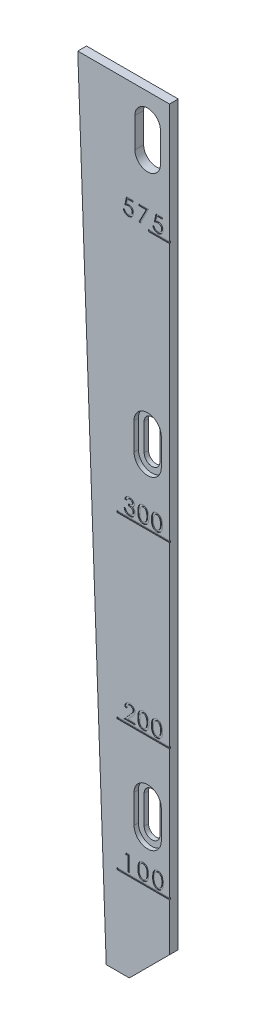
SolidWorks part; units mm, degrees
ref_plane "Front Plane" through (0, 0, 0) normal (0, 0, 1) x (1, 0, 0)
ref_plane "Top Plane" through (0, 0, 0) normal (0, 1, 0) x (1, 0, 0)
ref_plane "Right Plane" through (0, 0, 0) normal (1, 0, 0) x (0, 0, -1)
sketch "Sketch1" plane through (0, 0, 0) normal (0, 0, 1) x (1, 0, 0)
  line L0 (0, 0) -> (-29.7001, 0) construction
  line L1 (0, 0) -> (0, -107.0864) construction
  line L2 (0, 0) -> (-13.335, 0)
  line L3 (0, 0) -> (0, -107.0864)
  line L4 (-5.842, -112.9284) -> (-9.1948, -112.9284)
  line L5 (-13.335, 0) -> (-9.1948, -112.9284)
  line L6 (-3.175, 0) -> (-3.175, -112.9284) construction
  line L7 (-3.175, -3.9624) -> (-3.175, -8.2804) construction
  line L8 (-1.3208, -3.9624) -> (-1.3208, -8.2804)
  line L9 (-5.0292, -3.9624) -> (-5.0292, -8.2804)
  line L10 (-3.175, -42.4323) -> (-3.175, -46.3804) construction
  line L11 (-2.032, -42.4323) -> (-2.032, -46.3804)
  line L12 (-4.318, -42.4323) -> (-4.318, -46.3804)
  line L13 (-3.175, -93.3704) -> (-3.175, -89.2302) construction
  line L14 (-4.318, -93.3704) -> (-4.318, -89.2302)
  line L15 (-2.032, -93.3704) -> (-2.032, -89.2302)
  line L16 (-5.842, -112.9284) -> (0, -107.0864)
  line L17 (0, -112.9284) -> (0, -136.3505) construction
  arc A0 (-1.3208, -3.9624) -> (-5.0292, -3.9624) centre (-3.175, -3.9624) ccw
  arc A1 (-5.0292, -8.2804) -> (-1.3208, -8.2804) centre (-3.175, -8.2804) ccw
  arc A2 (-2.032, -42.4323) -> (-4.318, -42.4323) centre (-3.175, -42.4323) ccw
  arc A3 (-4.318, -46.3804) -> (-2.032, -46.3804) centre (-3.175, -46.3804) ccw
  arc A4 (-4.318, -93.3704) -> (-2.032, -93.3704) centre (-3.175, -93.3704) ccw
  arc A5 (-2.032, -89.2302) -> (-4.318, -89.2302) centre (-3.175, -89.2302) ccw
  point P11 (-3.175, -6.1214)
  point P16 (-3.175, -44.4064)
  point P23 (-3.175, -91.3003)
  point P30 (-7.5184, -112.9284)
  point P33 (-1.3208, -6.1214)
  dimension "D7" = 2.286
  dimension "D1" = 13.335
  dimension "D2" = 112.9284
  dimension "D3" = 9.1948
  dimension "D4" = 3.175
  dimension "D5" = 3.7084
  dimension "D6" = 4.318
  dimension "D8" = 2.286
  dimension "D9" = 19.558
  dimension "D10" = 4.1402
  dimension "D11" = 46.99
  dimension "D12" = 104.648
  dimension "D13" = 45
  dimension "D14" = 5.842
  dimension "D15" = 6.1214
extrude "Boss-Extrude1" add sketch "Sketch1" against normal blind 1.27
sketch "Sketch2" plane through (0, 0, 0) normal (0, 0, 1) x (1, 0, 0)
  line L0 (-3.175, -42.4323) -> (-3.175, -46.3804) construction
  line L1 (-1.1938, -42.4323) -> (-1.1938, -46.3804)
  line L2 (-5.1562, -42.4323) -> (-5.1562, -46.3804)
  line L3 (-3.175, -93.3704) -> (-3.175, -89.2302) construction
  line L4 (-5.1562, -93.3704) -> (-5.1562, -89.2302)
  line L5 (-1.1938, -93.3704) -> (-1.1938, -89.2302)
  arc A0 (-1.1938, -42.4323) -> (-5.1562, -42.4323) centre (-3.175, -42.4323) ccw
  arc A1 (-5.1562, -46.3804) -> (-1.1938, -46.3804) centre (-3.175, -46.3804) ccw
  arc A2 (-5.1562, -93.3704) -> (-1.1938, -93.3704) centre (-3.175, -93.3704) ccw
  arc A3 (-1.1938, -89.2302) -> (-5.1562, -89.2302) centre (-3.175, -89.2302) ccw
  point P4 (-3.175, -44.4064)
  point P13 (-3.175, -91.3003)
  dimension "D1" = 3.9624
  dimension "D2" = 3.9624
extrude "Cut-Extrude1" cut sketch "Sketch2" against normal blind 0.635
sketch "Sketch3" plane through (0, 0, 0) normal (0, 0, 1) x (1, 0, 0)
  line L0 (0, -55.0926) -> (-7.62, -55.0926) construction
  line L1 (0, -107.0864) -> (0, 0) construction
  line L2 (0, -81.0514) -> (-7.62, -81.0514) construction
  line L3 (0, -100.0506) -> (-7.62, -100.0506) construction
  line L4 (0, -54.9656) -> (-7.62, -54.9656)
  line L5 (0, -80.9244) -> (-7.62, -80.9244)
  line L6 (0, -99.9236) -> (-7.62, -99.9236)
  line L7 (0, -55.2196) -> (-7.62, -55.2196)
  line L8 (0, -81.1784) -> (-7.62, -81.1784)
  line L9 (0, -100.1776) -> (-7.62, -100.1776)
  line L10 (-7.62, -54.9656) -> (-7.62, -55.2196)
  line L11 (0, -54.9656) -> (0, -55.2196)
  line L12 (-7.62, -80.9244) -> (-7.62, -81.1784)
  line L13 (0, -80.9244) -> (0, -81.1784)
  line L14 (-7.62, -99.9236) -> (-7.62, -100.1776)
  line L15 (0, -99.9236) -> (0, -100.1776)
  line L16 (0, -17.4498) -> (-3.048, -17.4498) construction
  line L17 (0, -17.3228) -> (-3.048, -17.3228)
  line L18 (0, -17.5768) -> (-3.048, -17.5768)
  line L19 (-3.048, -17.3228) -> (-3.048, -17.5768)
  line L20 (0, -17.5768) -> (0, -17.3228)
  line L21 (0, 0) -> (-13.335, 0) construction
  dimension "D1" = 7.62
  dimension "D2" = 7.62
  dimension "D3" = 7.62
  dimension "D4" = 8.7122
  dimension "D5" = 25.9588
  dimension "D6" = 6.6802
  dimension "D9" = 3.048
  dimension "D12" = 17.4498
  dimension "D7" = 0.127
  dimension "D8" = 0.127
  dimension "D10" = 0.127
  dimension "D11" = 0.127
extrude "Cut-Extrude2" cut sketch "Sketch3" against normal blind 0.127 contours L17 L19 L18 M17 | L7 L10 L4 L11 | L8 L12 L5 L13 | L9 L14 L6 L15
sketch "Sketch4" plane through (0, 0, 0) normal (0, 0, 1) x (1, 0, 0)
  line L0 (0, -99.6696) -> (-7.6053, -99.6696)
  line L1 (0, -99.9236) -> (0, -81.1784) construction
  line L2 (0, -80.6704) -> (-7.6053, -80.6704)
  line L3 (0, -80.9244) -> (0, -55.2196) construction
  line L4 (0, -54.7116) -> (-7.6053, -54.7116)
  line L5 (0, -54.9656) -> (0, -17.5768) construction
  line L6 (0, -54.9656) -> (-7.62, -54.9656) construction
  line L7 (0, -80.9244) -> (-7.62, -80.9244) construction
  line L8 (0, -99.9236) -> (-7.62, -99.9236) construction
  line L9 (0, -17.0688) -> (-7.62, -17.0688)
  line L10 (0, -17.3228) -> (0, 0) construction
  line L11 (0, -17.3228) -> (-3.048, -17.3228) construction
  dimension "D1" = 0.254
  dimension "D2" = 0.254
  dimension "D3" = 0.254
  dimension "D4" = 7.62
  dimension "D5" = 0.254
sketch "Sketch5" plane through (0, 0, 0) normal (0, 0, 1) x (1, 0, 0)
  text T0 "300" font "Century Gothic" height 2.286
  text T1 "200" font "Century Gothic" height 2.286
  text T2 "100" font "Century Gothic" height 2.286
  text T3 "575" font "Century Gothic" height 2.286
extrude "Cut-Extrude3" cut sketch "Sketch5" against normal blind 0.127
